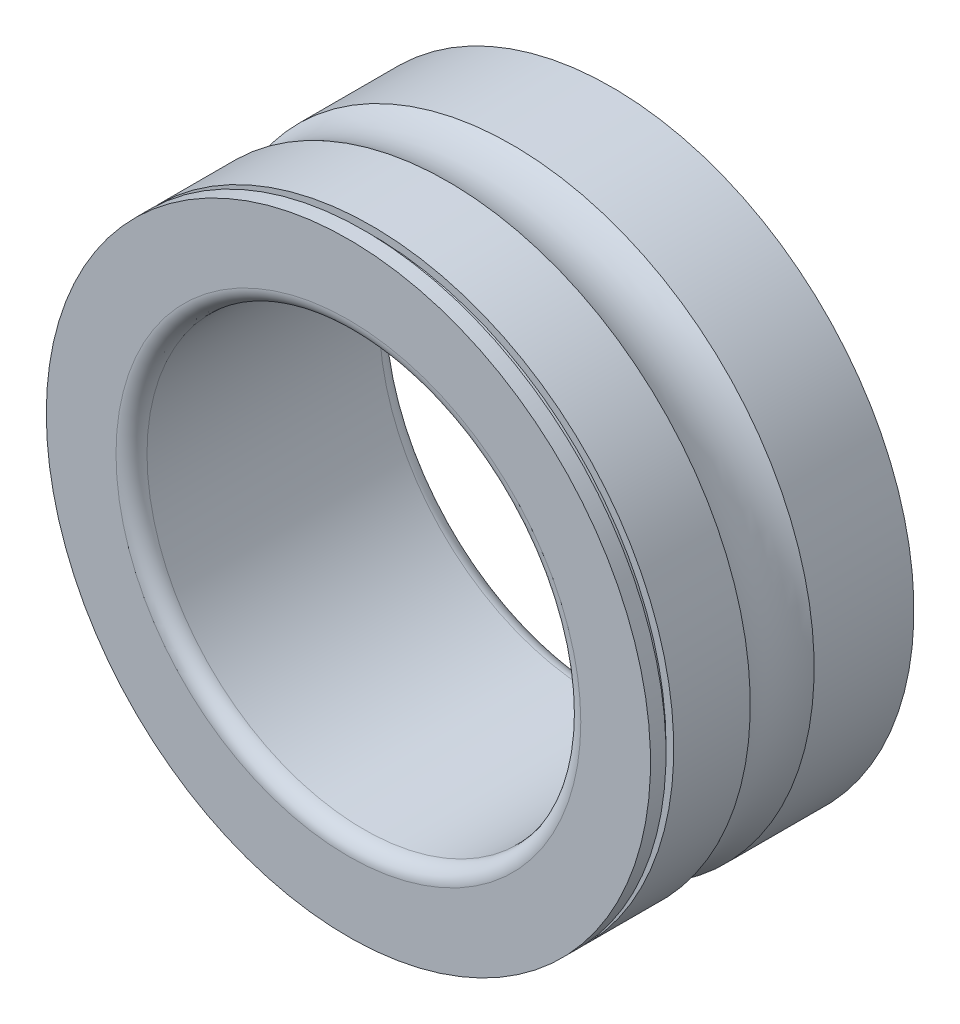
SolidWorks part; units mm, degrees
ref_plane "Plan1" through (0, 0, 0) normal (0, 0, 1) x (1, 0, 0)
ref_plane "Plan2" through (0, 0, 0) normal (0, 1, 0) x (1, 0, 0)
ref_plane "Plan3" through (0, 0, 0) normal (1, 0, 0) x (0, 0, -1)
sketch "Esquisse1" plane through (0, 0, 0) normal (1, 0, 0) x (0, 0, -1)
  line L0 (-4.25, 9.75) -> (-3.75, 9.75)
  line L1 (-4.25, 9.75) -> (-4.25, 7.5)
  line L2 (3.75, 7) -> (-3.75, 7)
  line L3 (4.25, 7.5) -> (4.25, 9.75)
  line L4 (0, 19) -> (0, -9) construction
  line L5 (0, 0) -> (-10, 0) construction
  line L6 (-3.75, 9.75) -> (-3.75, 9.5)
  line L7 (-3.75, 9.5) -> (-3.5, 9.5)
  line L8 (1.0308, 9.75) -> (4.25, 9.75)
  line L9 (-3.5, 9.5) -> (-3.5, 9.75)
  line L10 (-3.5, 9.75) -> (-1.0308, 9.75)
  arc A0 (-1.0308, 9.75) -> (1.0308, 9.75) centre (0, 11.75) ccw
  arc A1 (4.25, 7.5) -> (3.75, 7) centre (3.75, 7.5) cw
  arc A2 (-4.25, 7.5) -> (-3.75, 7) centre (-3.75, 7.5) ccw
  point P16 (4.25, 7)
  point P19 (-4.25, 7)
  dimension "D8" = 0.5
  dimension "D9" = 0.25
  dimension "D1" = 2.75
  dimension "D3" = 2
  dimension "D4" = 2.25
  dimension "D2" = 7
  dimension "D5" = 8.5
  dimension "D6" = 0.5
  dimension "D7" = 0.25
  dimension "D10" = 4.25
revolve "Base-Révolution" add sketch "Esquisse1" angle 360 about L5
